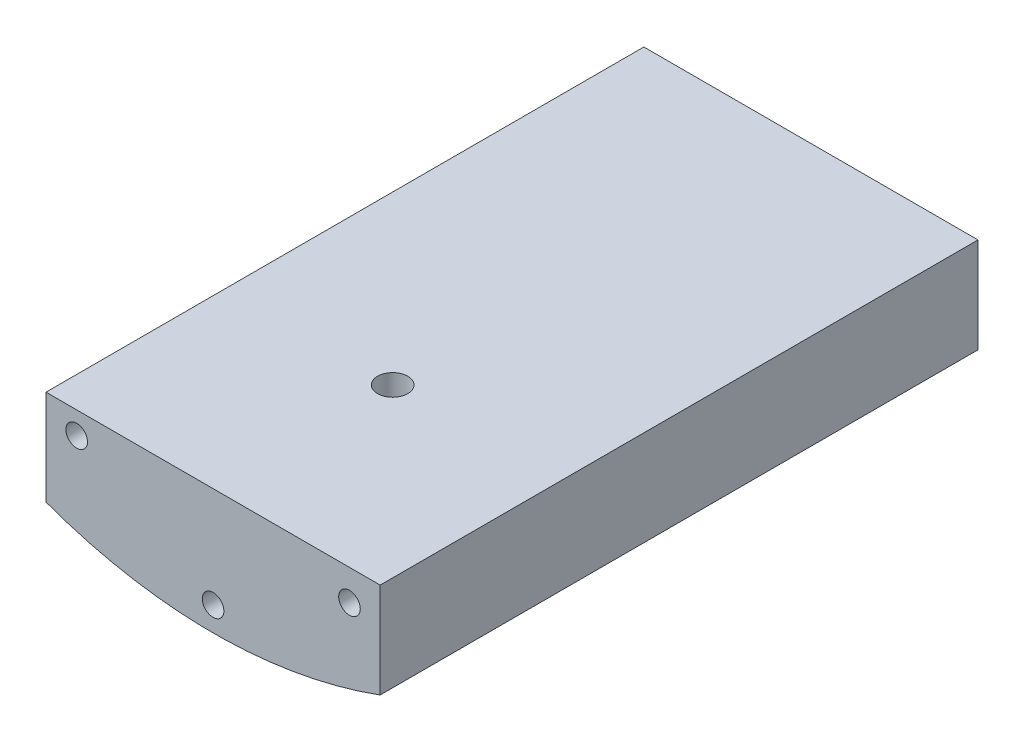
SolidWorks part; units mm, degrees
ref_plane "Front Plane" through (0, 0, 0) normal (0, 0, 1) x (1, 0, 0)
ref_plane "Top Plane" through (0, 0, 0) normal (0, 1, 0) x (1, 0, 0)
ref_plane "Right Plane" through (0, 0, 0) normal (1, 0, 0) x (0, 0, -1)
sketch "Sketch1" plane through (0, 0, 0) normal (0, 0, 1) x (1, 0, 0)
  line L5 (-37.338, 0) -> (37.338, 0)
  line L6 (-37.338, 0) -> (-37.338, -21.2771)
  line L8 (37.338, 0) -> (37.338, -21.2771)
  arc A0 (-37.338, -21.2771) -> (37.338, -21.2771) centre (0, 80.01) ccw
  dimension "D5" = 215.9
  dimension "D2" = 74.676
extrude "Boss-Extrude1" add sketch "Sketch1" along normal blind 133.604
hole_wizard "CBORE for 1/4 Pan Head Machine Screw1" positions "3DSketch1" profile "Sketch2" counterbore size "1/4" standard "Ansi Inch"
sketch3d "3DSketch1"
  point P0 (0, -27.94, 93.472)
  dimension "D1" = 40.132
sketch "Sketch2" plane through (0, -27.94, 93.472) normal (1, 0, 0) x (0, 0, -1)
  line L0 (0, 0) -> (0, 27.94)
  line L1 (0, 27.94) -> (3.3782, 27.94)
  line L3 (3.3782, 27.94) -> (3.3782, 4.445)
  line L4 (3.3782, 4.445) -> (6.7462, 4.445)
  line L5 (6.7462, 4.445) -> (6.7462, 0)
  line L7 (6.7462, 0) -> (0, 0)
  line L11 (0, -6.35) -> (0, 107.95) construction
  dimension "Thru Hole Dia." = 6.7564
  dimension "Thru Hole Depth" = 27.94
  dimension "C'Bore Dia." = 13.4925
  dimension "C'Bore Depth" = 4.445
hole_wizard "#10-32 Tapped Hole1" positions "Sketch4" profile "Sketch3" tap size "#10-32" standard "Ansi Inch"
sketch "Sketch4" plane through (0, 0, 133.604) normal (0, 0, 1) x (1, 0, 0)
  line L0 (37.338, 0) -> (-37.338, 0) construction
  line L1 (0, -15.367) -> (0, 15.367) construction
  point P0 (30.48, -6.858)
  point P1 (-30.48, -5.0004)
  point P3 (0, -22.5044)
  dimension "D1" = 6.858
  dimension "D2" = 22.5044
  dimension "D3" = 60.96
  dimension "D4" = 30.48
sketch "Sketch3" plane through (30.48, -6.858, 133.604) normal (1, 0, 0) x (0, -1, 0)
  line L0 (0, 0) -> (0, 133.604)
  line L1 (0, 133.604) -> (2.413, 133.604)
  line L2 (2.413, 133.604) -> (2.413, 0)
  line L5 (2.413, 0) -> (0, 0)
  line L11 (0, -6.35) -> (0, 107.95) construction
  dimension "Thread Major Dia." = 4.826
  dimension "Thru Tap Drill Depth" = 133.604
